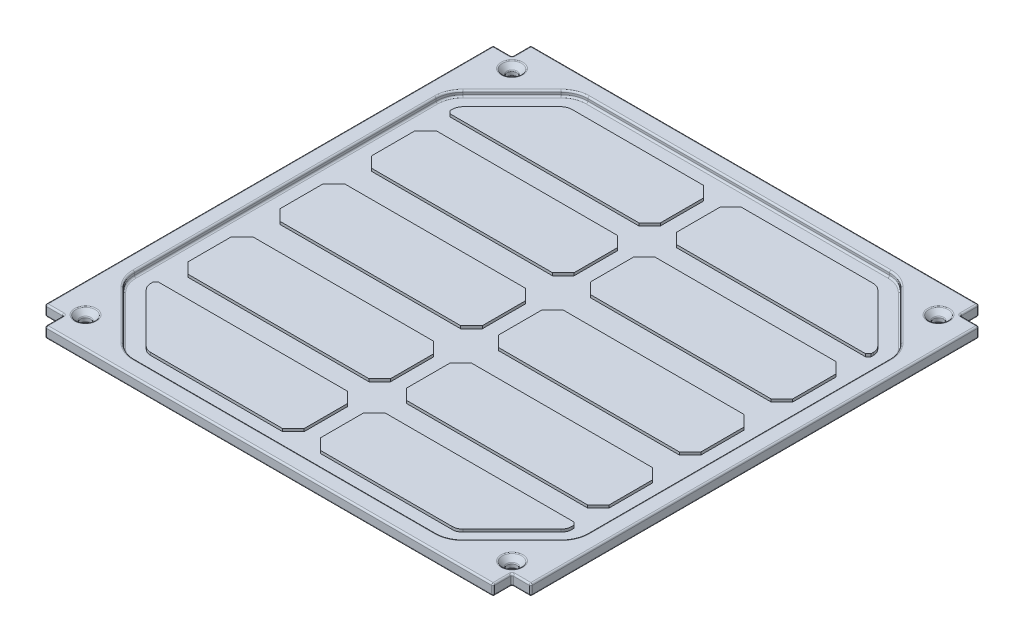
SolidWorks part; units mm, degrees
ref_plane "Front Plane" through (0, 0, 0) normal (0, 0, 1) x (1, 0, 0)
ref_plane "Top Plane" through (0, 0, 0) normal (0, 1, 0) x (1, 0, 0)
ref_plane "Right Plane" through (0, 0, 0) normal (1, 0, 0) x (0, 0, -1)
imported_body "Stock-cubesat - Master-1"
sketch "Sketch1" plane through (0, 50, 0) normal (0, 1, 0) x (1, 0, 0)
  line L0 (41.5, 45) -> (-41.5, 45) construction
  line L1 (-30, -42) -> (30, -42)
  line L2 (-42, -30) -> (-42, 30)
  line L3 (-30, 42) -> (30, 42)
  line L4 (42, -30) -> (42, 30)
  line L5 (-42, -42) -> (42, 42) construction
  line L6 (-42, 42) -> (42, -42) construction
  line L7 (-45, 41.5) -> (-45, -41.5) construction
  line L8 (-42, 30) -> (-30, 42)
  line L9 (30, 42) -> (42, 30)
  line L10 (30, -42) -> (42, -30)
  line L11 (-42, -30) -> (-30, -42)
  point P0 (0, 0)
  dimension "D1" = 3
  dimension "D2" = 3
extrude "Cut-Extrude1" cut sketch "Sketch1" against normal blind 1
fillet "Fillet1" radius 5 8 edges at (-42, 49.5, 30) (-30, 49.5, 42) (30, 49.5, 42) (42, 49.5, 30) (42, 49.5, -30) (30, 49.5, -42) (-42, 49.5, -30) (-30, 49.5, -42)
sketch "Sketch2" plane through (0, 49, 0) normal (0, 1, 0) x (1, 0, 0)
  line L0 (-3.5, 39) -> (-1.5, 37)
  line L1 (-37, 11) -> (-39, 13)
  line L2 (-37, 23) -> (-39, 21)
  line L3 (-39, 4) -> (-37, 6)
  line L4 (-37, -6) -> (-39, -4)
  line L5 (-39, -13) -> (-37, -11)
  line L6 (-37, -23) -> (-39, -21)
  line L7 (-1.5, 37) -> (-1.5, 29)
  line L8 (-3.5, 27) -> (-1.5, 29)
  line L9 (-1.5, 21) -> (-1.5, 13)
  line L10 (-1.5, 21) -> (-3.5, 23)
  line L11 (-1.5, -13) -> (-1.5, -21)
  line L12 (-1.5, -29) -> (-1.5, -37)
  line L13 (-1.5, -4) -> (-3.5, -6)
  line L14 (-1.5, -13) -> (-3.5, -11)
  line L15 (-1.5, -21) -> (-3.5, -23)
  line L16 (-3.5, -27) -> (-1.5, -29)
  line L17 (-1.5, -37) -> (-3.5, -39)
  line L18 (-1.5, 4) -> (-1.5, -4)
  line L19 (-1.5, 13) -> (-3.5, 11)
  line L20 (-1.5, 4) -> (-3.5, 6)
  line L21 (-39, 27.5) -> (-38.5, 27)
  line L22 (-39, -27.5) -> (-38.5, -27)
  line L28 (-38.5, 27) -> (-3.5, 27)
  line L29 (-39, -4) -> (-39, 4)
  line L30 (-3.5, 11) -> (-37, 11)
  line L32 (-3.5, 23) -> (-37, 23)
  line L38 (-39, 27.9289) -> (-39, 27.5)
  line L41 (-3.5, 39) -> (-27.9289, 39)
  line L42 (-29.3431, 38.4142) -> (-38.4142, 29.3431)
  line L43 (-39, 13) -> (-39, 21)
  line L46 (-3.5, -6) -> (-37, -6)
  line L48 (-3.5, 6) -> (-37, 6)
  line L49 (-39, -21) -> (-39, -13)
  line L50 (-3.5, -23) -> (-37, -23)
  line L52 (-3.5, -11) -> (-37, -11)
  line L54 (-3.5, -39) -> (-27.9289, -39)
  line L57 (-39, -27.9289) -> (-39, -27.5)
  line L58 (-29.3431, -38.4142) -> (-38.4142, -29.3431)
  line L59 (-38.5, -27) -> (-3.5, -27)
  arc A21 (-38.4142, -29.3431) -> (-39, -27.9289) centre (-37, -27.9289) cw
  arc A22 (-27.9289, -39) -> (-29.3431, -38.4142) centre (-27.9289, -37) cw
  arc A29 (-38.4142, 29.3431) -> (-39, 27.9289) centre (-37, 27.9289) ccw
  arc A32 (-27.9289, 39) -> (-29.3431, 38.4142) centre (-27.9289, 37) ccw
  point P0 (-39, 27)
  point P2 (0, 17)
  point P3 (-39, 23)
  point P6 (-39, 11)
  point P7 (-39, 6)
  point P11 (-39, -6)
  point P12 (-39, -11)
  point P23 (-1.5, 39)
  point P24 (-1.5, -39)
  point P28 (-1.5, 27)
  point P29 (-39, -23)
  point P30 (-1.5, 23)
  point P31 (-1.5, 11)
  point P37 (-1.5, 6)
  point P38 (-1.5, -6)
  point P39 (-1.5, -11)
  point P40 (-1.5, -23)
  point P41 (-1.5, -27)
  point P43 (-39, -27)
  dimension "D2" = 12
  dimension "D3" = 12
  dimension "D4" = 4
extrude "Boss-Extrude1" add sketch "Sketch2" along normal blind 0.5 separate body
mirror "Mirror1" about plane through (0, 0, 0) normal (1, 0, 0)
fillet "Fillet2" radius 0.3 80 edges at (-29.8423, 50, -41.6194) (-41.6194, 50, -29.8423) (29.8423, 50, -41.6194) (41.6194, 50, -29.8423) (41.6194, 50, 29.8423) (29.8423, 50, 41.6194) (-29.8423, 50, 41.6194) (-41.6194, 50, 29.8423) (-41.6194, 49, 29.8423) (-29.8423, 49, 41.6194) (29.8423, 49, 41.6194) (41.6194, 49, 29.8423) (41.6194, 49, -29.8423) (29.8423, 49, -41.6194) (-41.6194, 49, -29.8423) (-29.8423, 49, -41.6194) (-39.5, 49, -38.6) (39.5, 49, -38.6) (39.5, 49, 40.4) (-39.5, 50, 41.4) (39.5, 50, 41.4) (39.5, 50, -37.6) (-39.5, 50, -37.6) (-39.5, 49, 40.4) (45, 49, 41.5) (45, 49, -41.5) (41.5, 49, -41.5) (41.5, 49, -45) (-41.5, 49, -45) (-41.5, 49, -41.5) (-45, 49, -41.5) (-45, 49, 41.5) (-41.5, 49, 41.5) (-41.5, 49, 45) (41.5, 49, 45) (41.5, 49, 41.5) (41.5, 50, 43.25) (0, 50, 45) (-41.5, 50, 43.25) (-43.25, 50, 41.5) (-45, 50, 0) (-43.25, 50, -41.5) (-41.5, 50, -43.25) (0, 50, -45) (41.5, 50, -43.25) (43.25, 50, -41.5) (45, 50, 0) (43.25, 50, 41.5) (41.5, 48, 43.25) (0, 48, 45) (-41.5, 48, 43.25) (-43.25, 48, 41.5) (-45, 48, 0) (-43.25, 48, -41.5) (-41.5, 48, -43.25) (0, 48, -45) (41.5, 48, -43.25) (43.25, 48, -41.5) (45, 48, 0) (43.25, 48, 41.5) (-39.5, 48, -38.6) (39.5, 48, -38.6) (39.5, 48, 40.4) (-39.5, 48, 40.4) (0, 49, -42) (36, 49, -36) (42, 49, 0) (36, 49, 36) (0, 49, 42) (-36, 49, 36) (-42, 49, 0) (-36, 49, -36) (0, 50, -42) (36, 50, -36) (42, 50, 0) (36, 50, 36) (0, 50, 42) (-36, 50, 36) (-42, 50, 0) (-36, 50, -36)
